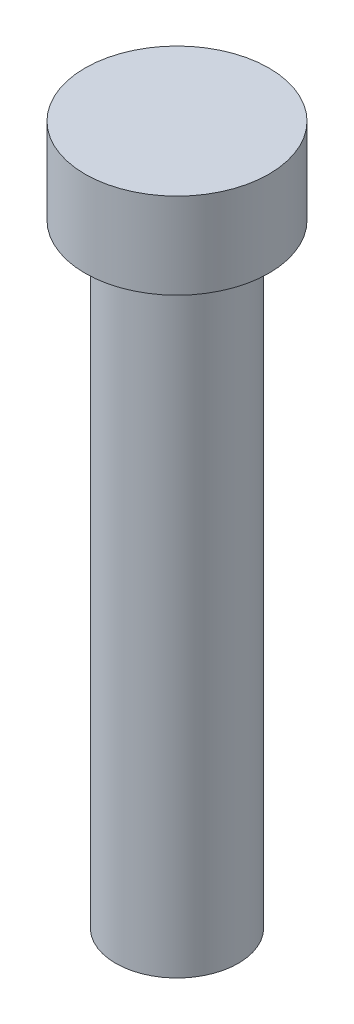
SolidWorks part; units mm, degrees
ref_plane "Front Plane" through (0, 0, 0) normal (0, 0, 1) x (1, 0, 0)
ref_plane "Top Plane" through (0, 0, 0) normal (0, 1, 0) x (1, 0, 0)
ref_plane "Right Plane" through (0, 0, 0) normal (1, 0, 0) x (0, 0, -1)
sketch "Sketch1" plane through (0, 0, 0) normal (0, 1, 0) x (1, 0, 0)
  circle A0 centre (0, 0) radius 5
  dimension "D1" = 10
extrude "Boss-Extrude1" add sketch "Sketch1" along normal blind 50
sketch "Sketch2" plane through (0, 50, 0) normal (0, 1, 0) x (1, 0, 0)
  circle A0 centre (0, 0) radius 7.5
  dimension "D1" = 15
extrude "Boss-Extrude2" add sketch "Sketch2" along normal blind 7
